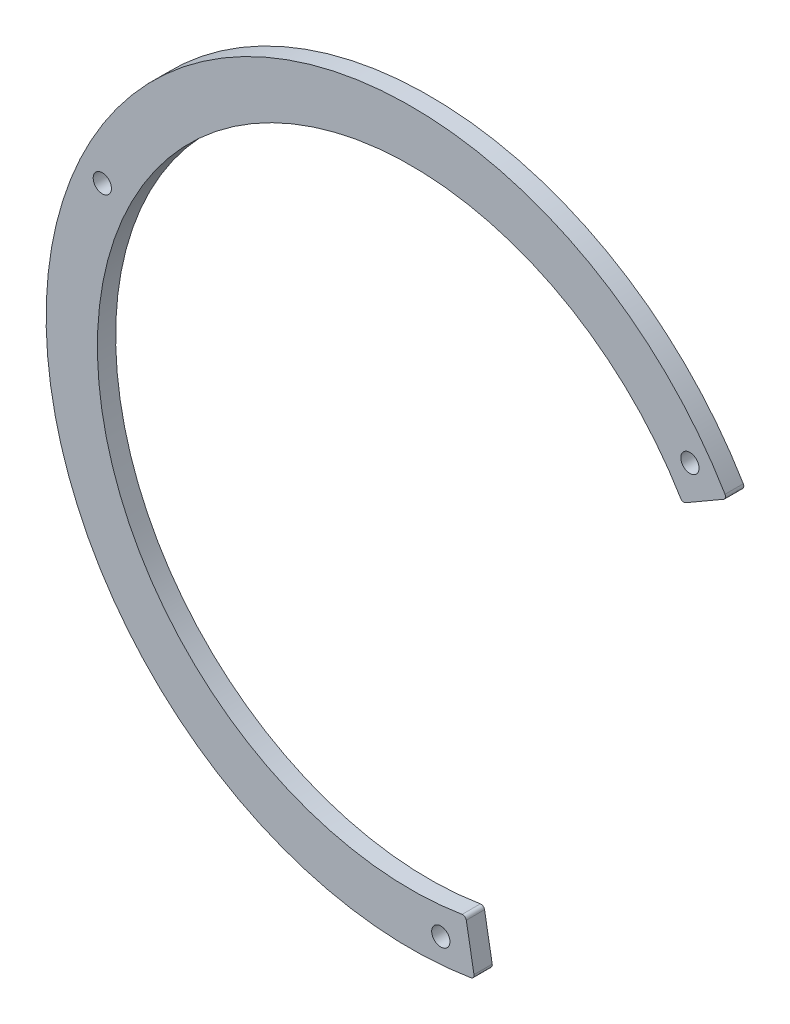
SolidWorks part; units mm, degrees
ref_plane "Alzado" through (0, 0, 0) normal (0, 0, 1) x (1, 0, 0)
ref_plane "Planta" through (0, 0, 0) normal (0, 1, 0) x (1, 0, 0)
ref_plane "Vista lateral" through (0, 0, 0) normal (1, 0, 0) x (0, 0, -1)
sketch "Croquis1" plane through (0, 0, 0) normal (0, 0, 1) x (1, 0, 0)
  line L0 (0, 0) -> (8.1667, -92.9754) construction
  line L1 (0, 0) -> (0, -50000) construction
  line L2 (0, 0) -> (8716.4395, -49234.375) construction
  line L3 (14.9837, -84.6346) -> (17.4329, -98.4688)
  line L4 (86.568, 50.0598) -> (74.4058, 43.0268)
  line L5 (0, 0) -> (74.4058, 43.0268) construction
  line L6 (8.1667, -92.9754) -> (14.9837, -84.6346) construction
  line L7 (8.1667, -92.9754) -> (17.4329, -98.4688) construction
  circle A0 centre (76.4357, 53.5602) radius 2.5 construction
  arc A1 (17.4329, -98.4688) -> (86.568, 50.0598) centre (0, 0) cw
  arc A2 (14.9837, -84.6346) -> (74.4058, 43.0268) centre (0, 0) cw
  circle A3 centre (8.1667, -92.9754) radius 2.5 construction
  circle A4 centre (-84.6024, 39.4151) radius 2.5 construction
  circle A5 centre (76.4357, 53.5602) radius 2.5
  circle A6 centre (8.1667, -92.9754) radius 2.5
  circle A7 centre (-84.6024, 39.4151) radius 2.5
  dimension "D5" = 100
  dimension "D1" = 5.02
  dimension "D2" = 5.02
  dimension "D3" = 14.0493
  dimension "D4" = 110
extrude "Saliente-Extruir1" add sketch "Croquis1" along normal blind 5
fillet "Redondeo1" radius 1 4 edges at (86.568, 50.0598, 2.5) (74.4058, 43.0268, 2.5) (14.9837, -84.6346, 2.5) (17.4329, -98.4688, 2.5)
